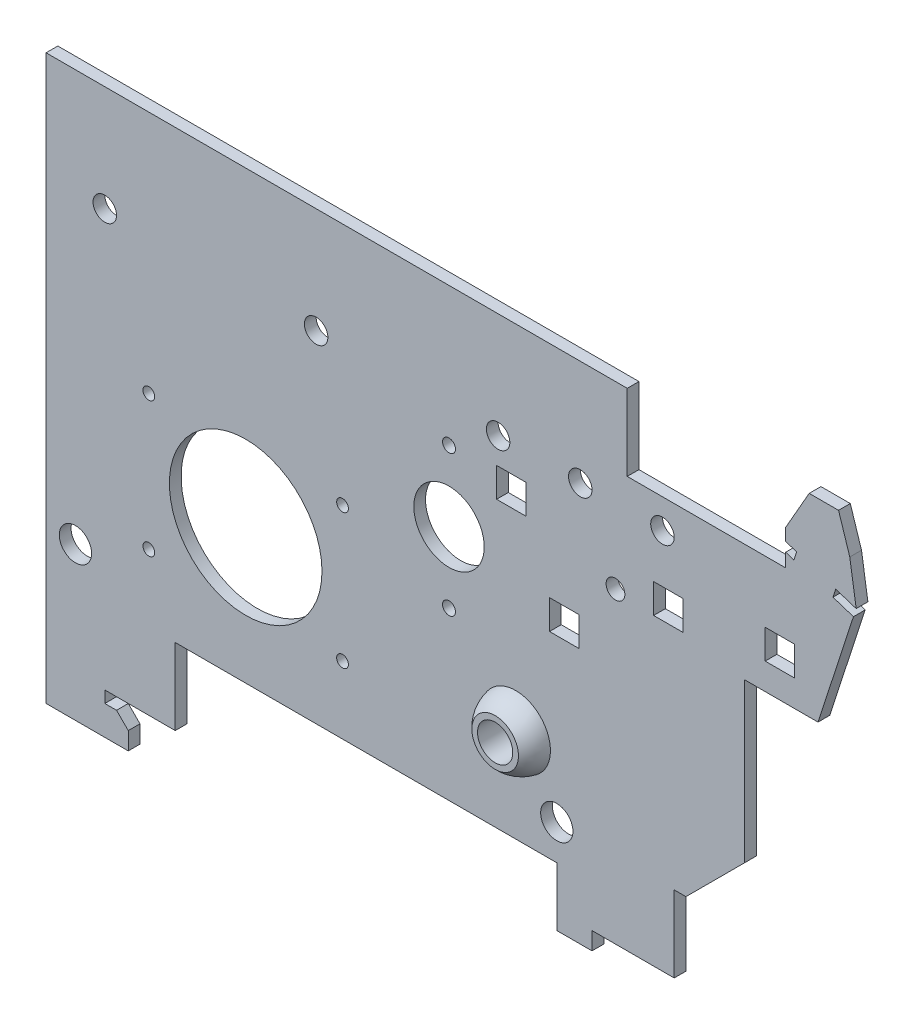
SolidWorks part; units mm, degrees
ref_plane "Face" through (0, 0, 0) normal (0, 0, 1) x (1, 0, 0)
ref_plane "Dessus" through (0, 0, 0) normal (0, 1, 0) x (1, 0, 0)
ref_plane "Droite" through (0, 0, 0) normal (1, 0, 0) x (0, 0, -1)
sketch "Esquisse1" plane through (0, 0, 0) normal (0, 0, 1) x (1, 0, 0)
  line L0 (7, -16) -> (-58, -16)
  line L1 (-58, -16) -> (-58, -29)
  line L2 (-58, -29) -> (-70, -29)
  line L3 (-70, -29) -> (-70, -31)
  line L4 (-70, -31) -> (-68, -31)
  line L5 (-68, -31) -> (-66, -33)
  line L6 (-66, -33) -> (-66, -36)
  line L7 (-66, -36) -> (-80, -36)
  line L8 (-80, -36) -> (-80, 60)
  line L9 (7, -16) -> (7, -26)
  line L10 (7, -26) -> (13, -26)
  line L11 (13, -26) -> (13, -23)
  line L12 (13, -23) -> (27, -23)
  line L13 (39, -10) -> (27, -10)
  line L14 (27, -10) -> (27, -23)
  line L17 (39, -10) -> (39, 27)
  line L18 (39, 27) -> (51.5, 27)
  line L19 (51.5, 27) -> (58, 47)
  line L20 (-80, 60) -> (19, 60)
  line L21 (19, 60) -> (19, 47)
  line L22 (19, 47) -> (46, 47)
  line L23 (46, 47) -> (46, 53)
  line L24 (46, 53) -> (50, 60)
  line L25 (50, 60) -> (56, 60)
  line L26 (56, 60) -> (58, 47)
  dimension "D1" = 16
  dimension "D2" = 7
  dimension "D3" = 65
  dimension "D4" = 13
  dimension "D5" = 12
  dimension "D6" = 2
  dimension "D7" = 2
  dimension "D8" = 5
  dimension "D9" = 14
  dimension "D10" = 135
  dimension "D11" = 96
  dimension "D12" = 6
  dimension "D13" = 26
  dimension "D14" = 3
  dimension "D15" = 37
  dimension "D16" = 14
  dimension "D17" = 12
  dimension "D18" = 13
  dimension "D21" = 12.5
  dimension "D22" = 99
  dimension "D23" = 13
  dimension "D24" = 27
  dimension "D25" = 6
  dimension "D26" = 8
  dimension "D27" = 13
  dimension "D28" = 31
  dimension "D29" = 6
  dimension "D30" = 19
  dimension "D31" = 20
extrude "Extrusion1" add sketch "Esquisse1" along normal mid plane 2
sketch "Esquisse2" plane through (0, 0, 0) normal (0, 0, 1) x (1, 0, 0)
  circle A0 centre (7, -10) radius 2.75
  circle A1 centre (-75, -10) radius 2.75
  dimension "D1" = 5.5
  dimension "D3" = 10
  dimension "D5" = 5.5
  dimension "D6" = 82
  dimension "D2" = 7
  dimension "D4" = 10
extrude "Enlèv. mat.-Extru.2" cut sketch "Esquisse2" along normal through all and the other way through all
sketch "Esquisse3" plane through (0, 0, 0) normal (0, 0, 1) x (1, 0, 0)
  circle A0 centre (-46, 7) radius 13
  dimension "D2" = 7
  dimension "D3" = 26
  dimension "D1" = 46
extrude "Enlèv. mat.-Extru.4" cut sketch "Esquisse3" along normal through all and the other way through all
sketch "Esquisse4" plane through (0, 0, 0) normal (0, 0, 1) x (1, 0, 0)
  line L0 (0, 10.5146) -> (0, -8.7169) construction
  line L1 (0, -6) -> (0, 6)
  arc A0 (0, 6) -> (0, -6) centre (0, 0) ccw
  dimension "D1" = 12
revolve "Révolution1" add sketch "Esquisse4" angle 360 about L0
sketch "Esquisse5" plane through (0, 0, 0) normal (0, 1, 0) x (1, 0, 0)
  line L1 (-6.6856, 4.5) -> (7.0735, 4.5)
  line L2 (-6.6856, 4.5) -> (-6.6856, 12.7868)
  line L3 (-6.6856, 12.7868) -> (7.0735, 12.7868)
  line L4 (7.0735, 4.5) -> (7.0735, 12.7868)
  line L5 (-6.6856, -4.5) -> (7.0735, -4.5)
  line L6 (-6.6856, -4.5) -> (-6.6856, -9.347)
  line L7 (-6.6856, -9.347) -> (7.0735, -9.347)
  line L8 (7.0735, -4.5) -> (7.0735, -9.347)
  dimension "D1" = 4.5
  dimension "D2" = 9
extrude "Enlèv. mat.-Extru.5" cut sketch "Esquisse5" against normal through all and the other way through all
sketch "Esquisse6" plane through (0, 0, -4.5) normal (0, 0, -1) x (-1, 0, 0)
  circle A0 centre (0, 0) radius 3
  dimension "D1" = 6
extrude "Enlèv. mat.-Extru.6" cut sketch "Esquisse6" against normal through all
sketch "Esquisse7" plane through (0, 0, -1) normal (0, 0, -1) x (-1, 0, 0)
  line L0 (-46, 50.9) -> (-46, 49.3228)
  line L1 (-46, 50.9) -> (-47.8586, 50.296)
  line L2 (-46, 53) -> (-46, 47) construction
  line L3 (-47.8586, 50.296) -> (-47.3949, 48.8694)
  line L4 (-58, 47) -> (-57.5364, 45.5734)
  line L5 (-58, 47) -> (-54.5158, 48.1324)
  line L6 (-54.0522, 46.7058) -> (-54.5158, 48.1324)
  line L8 (-47.3949, 48.8694) -> (-46, 49.3228)
  line L9 (-51.5, 27) -> (-58, 47) construction
  line L10 (-57.5364, 45.5734) -> (-54.0522, 46.7058)
  dimension "D1" = 7
  dimension "D2" = 1.5
  dimension "D4" = 1.9542
  dimension "D5" = 1.5
extrude "Enlèv. mat.-Extru.7" cut sketch "Esquisse7" against normal through all
chamfer "Chanfrein1" distance 10 angle 45 1 edges at (39, -10, 0)
sketch "Esquisse9" plane through (0, 0, 1) normal (0, 0, 1) x (1, 0, 0)
  circle A1 centre (17, 29.37) radius 1.6
  dimension "D4" = 3.2
  dimension "D5" = 17
  dimension "D6" = 29.37
extrude "Enlèv. mat.-Extru.9" cut sketch "Esquisse9" against normal through all
ref_plane "Plan1" through (0, 0, 1) normal (0, 0, 1) x (1, 0, 0)
sketch "Esquisse11" plane through (0, 0, -1) normal (0, 0, -1) x (-1, 0, 0)
  circle A0 centre (29.5, 18.5) radius 1
  circle A1 centre (62.5, 18.5) radius 1
  circle A2 centre (62.5, -4.5) radius 1
  circle A3 centre (29.5, -4.5) radius 1
extrude "Enlèv. mat.-Extru.11" cut sketch "Esquisse11" against normal through all
sketch "Esquisse12" plane through (0, 0, 1) normal (0, 0, 1) x (1, 0, 0)
  line L0 (45, 50.077) -> (45, -2.4215) construction
  line L1 (7.0529, 34) -> (49.7987, 34) construction
  line L2 (26, 30.0288) -> (26, -43.3472) construction
  line L3 (42.5, 36.5) -> (47.5, 36.5)
  line L4 (42.5, 36.5) -> (42.5, 31.5)
  line L5 (42.5, 31.5) -> (47.5, 31.5)
  line L6 (47.5, 36.5) -> (47.5, 31.5)
  line L7 (-12.1769, 31.2359) -> (28.8557, 31.2359) construction
  line L8 (-7.4589, 20) -> (59.683, 20) construction
  line L9 (10.7587, 22.5) -> (10.7587, 17.5)
  line L10 (23.5, 33.7359) -> (28.5, 33.7359)
  line L11 (23.5, 33.7359) -> (23.5, 28.7359)
  line L12 (23.5, 28.7359) -> (28.5, 28.7359)
  line L13 (28.5, 33.7359) -> (28.5, 28.7359)
  line L14 (5.7587, 22.5) -> (10.7587, 22.5)
  line L15 (5.7587, 22.5) -> (5.7587, 17.5)
  line L16 (5.7587, 17.5) -> (10.7587, 17.5)
  line L17 (-19.6687, 35) -> (17.0942, 35) construction
  line L18 (-0.7552, 35) -> (-26.6701, 9.085) construction
  line L19 (-3.2552, 37.5) -> (1.7448, 37.5)
  line L20 (-3.2552, 37.5) -> (-3.2552, 32.5)
  line L21 (-3.2552, 32.5) -> (1.7448, 32.5)
  line L22 (1.7448, 37.5) -> (1.7448, 32.5)
  circle A0 centre (-11.3618, 24.3934) radius 6
  point P21 (8.2587, 20)
  point P23 (26, 31.2359)
  point P24 (45, 34)
  point P28 (-0.7552, 35)
  point P35 (-11.3618, 24.3934)
  dimension "D27" = 12
  dimension "D1" = 45
  dimension "D2" = 34
  dimension "D3" = 5
  dimension "D4" = 5
  dimension "D5" = 2.5
  dimension "D6" = 2.5
  dimension "D7" = 26
  dimension "D8" = 19.2
  dimension "D9" = 20
  dimension "D10" = 5
  dimension "D11" = 5
  dimension "D12" = 2.5
  dimension "D13" = 2.5
  dimension "D14" = 21
  dimension "D15" = 5
  dimension "D16" = 2.5
  dimension "D17" = 2.5
  dimension "D18" = 5
  dimension "D19" = 35
  dimension "D20" = 17.5
  dimension "D21" = 5
  dimension "D22" = 5
  dimension "D23" = 2.5
  dimension "D24" = 2.5
  dimension "D25" = 45
  dimension "D26" = 15
extrude "Enlèv. mat.-Extru.12" cut sketch "Esquisse12" against normal through all
sketch "Esquisse13" plane through (0, 0, 1) normal (0, 0, 1) x (1, 0, 0)
  line L0 (-11.3618, 34.0667) -> (-11.3618, 12.4854) construction
  circle A0 centre (-11.3618, 36.3934) radius 1.1
  circle A1 centre (-11.3618, 12.3934) radius 1.1
  circle A2 centre (-11.3618, 24.3934) radius 6 construction
  dimension "D1" = 2.2
  dimension "D2" = 2.2
  dimension "D3" = 24
  dimension "D4" = 12
extrude "Enlèv. mat.-Extru.13" cut sketch "Esquisse13" against normal through all
sketch "Esquisse14" plane through (0, 0, 1) normal (0, 0, 1) x (1, 0, 0)
  circle A0 centre (-70, 42) radius 2
  circle A1 centre (-34, 42) radius 2
  circle A2 centre (-3, 42) radius 2
  circle A3 centre (11, 42) radius 2
  circle A4 centre (25, 42) radius 2
extrude "Enlèv. mat.-Extru.14" cut sketch "Esquisse14" against normal through all
chamfer "Chanfrein2" distance 6 distance2 1 1 edges at (56, 60, 0)
